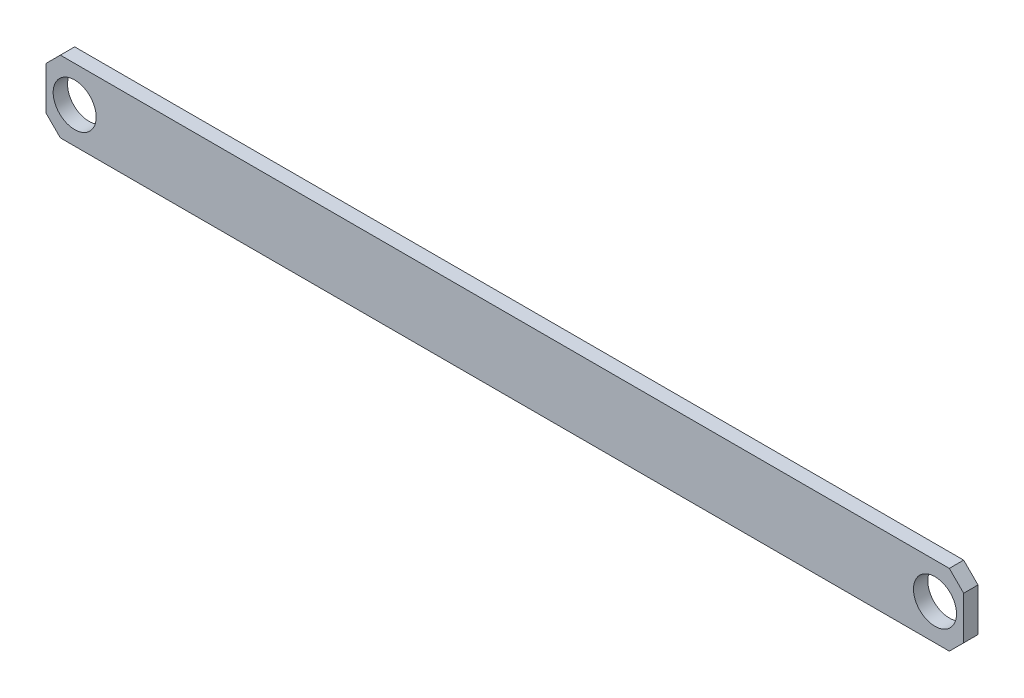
SolidWorks part; units mm, degrees
ref_plane "Plane1" through (0, 0, 0) normal (0, 0, 1) x (1, 0, 0)
ref_plane "Plane2" through (0, 0, 0) normal (0, 1, 0) x (1, 0, 0)
ref_plane "Plane3" through (0, 0, 0) normal (1, 0, 0) x (0, 0, -1)
sketch "Sketch1" plane through (0, 0, 0) normal (0, 0, 1) x (1, 0, 0)
  line L0 (0, 0) -> (203.2, 0)
  line L1 (0, 0) -> (0, 15.875)
  line L2 (203.2, 15.875) -> (0, 15.875)
  line L3 (203.2, 15.875) -> (203.2, 0)
  dimension "D1" = 15.875
  dimension "D2" = 203.2
extrude "Base-Extrude" add sketch "Sketch1" along normal blind 3.175
sketch "Sketch2" plane through (0, 0, 3.175) normal (0, 0, 1) x (1, 0, 0)
  line L0 (0, 7.9375) -> (17.2602, 7.9375) construction
  line L1 (0, 0) -> (0, 15.875) construction
  circle A0 centre (6.35, 7.9375) radius 4.7625
  dimension "D1" = 9.525
  dimension "D2" = 6.35
extrude "Cut-Extrude1" cut sketch "Sketch2" against normal through all
sketch "Sketch3" plane through (185.2696, -0.2287, 3.175) normal (0, 0, 1) x (1, 0, 0)
  line L0 (-25.4, 8.1662) -> (17.9304, 8.1662) construction
  line L1 (17.9304, 16.1037) -> (17.9304, 0.2287) construction
  circle A0 centre (11.5804, 8.1662) radius 4.7625
  dimension "D1" = 9.525
  dimension "D2" = 6.35
extrude "Cut-Extrude2" cut sketch "Sketch3" against normal through all
chamfer "Chamfer1" distance 3.175 angle 45 2 edges at (0, 0, 1.5875) (0, 15.875, 1.5875)
chamfer "Chamfer2" distance 3.175 angle 45 2 edges at (203.2, 0, 1.5875) (203.2, 15.875, 1.5875)
